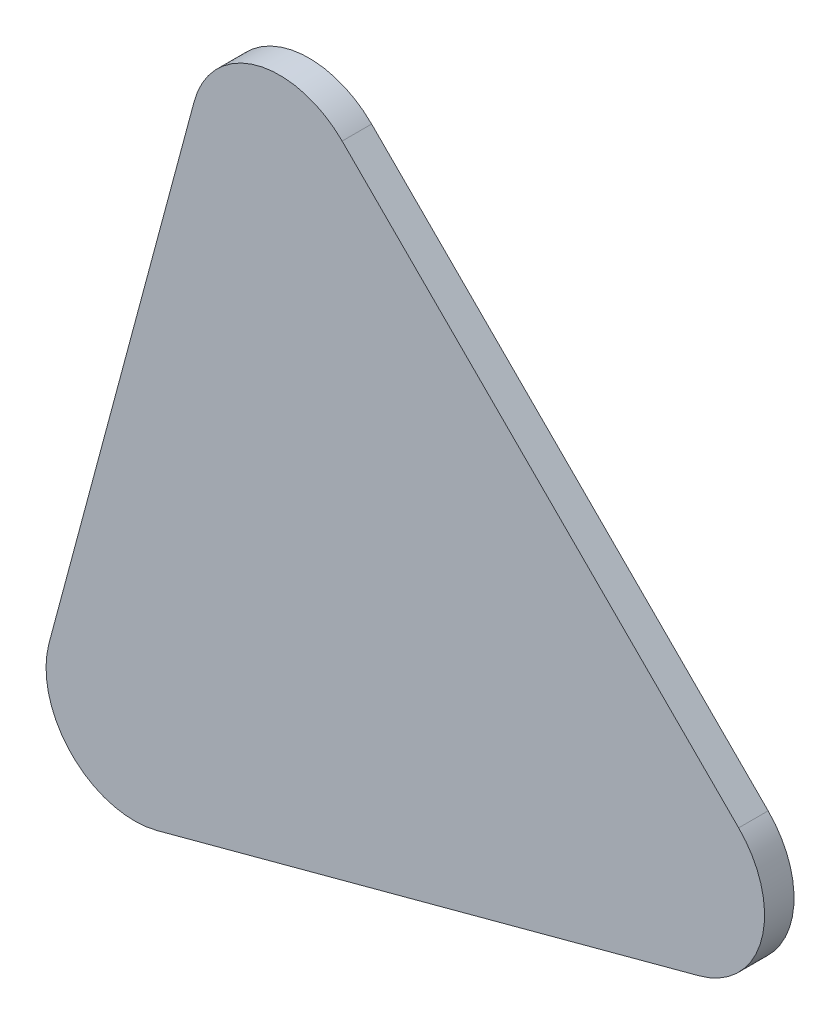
SolidWorks part; units mm, degrees
ref_plane "Front Plane" through (0, 0, 0) normal (0, 0, 1) x (1, 0, 0)
ref_plane "Top Plane" through (0, 0, 0) normal (0, 1, 0) x (1, 0, 0)
ref_plane "Right Plane" through (0, 0, 0) normal (1, 0, 0) x (0, 0, -1)
sketch "Sketch2" plane through (0, 0, 0) normal (0, 0, 1) x (1, 0, 0)
  line L0 (0, 0) -> (20.8006, -20.8006)
  line L1 (20.8006, -20.8006) -> (-7.6136, -28.4142)
  line L2 (-7.6136, -28.4142) -> (0, 0)
extrude "Boss-Extrude1" add sketch "Sketch2" along normal blind 1
fillet "Fillet1" radius 3 3 edges at (-7.6136, -28.4142, 0.5) (0, 0, 0.5) (20.8006, -20.8006, 0.5)
